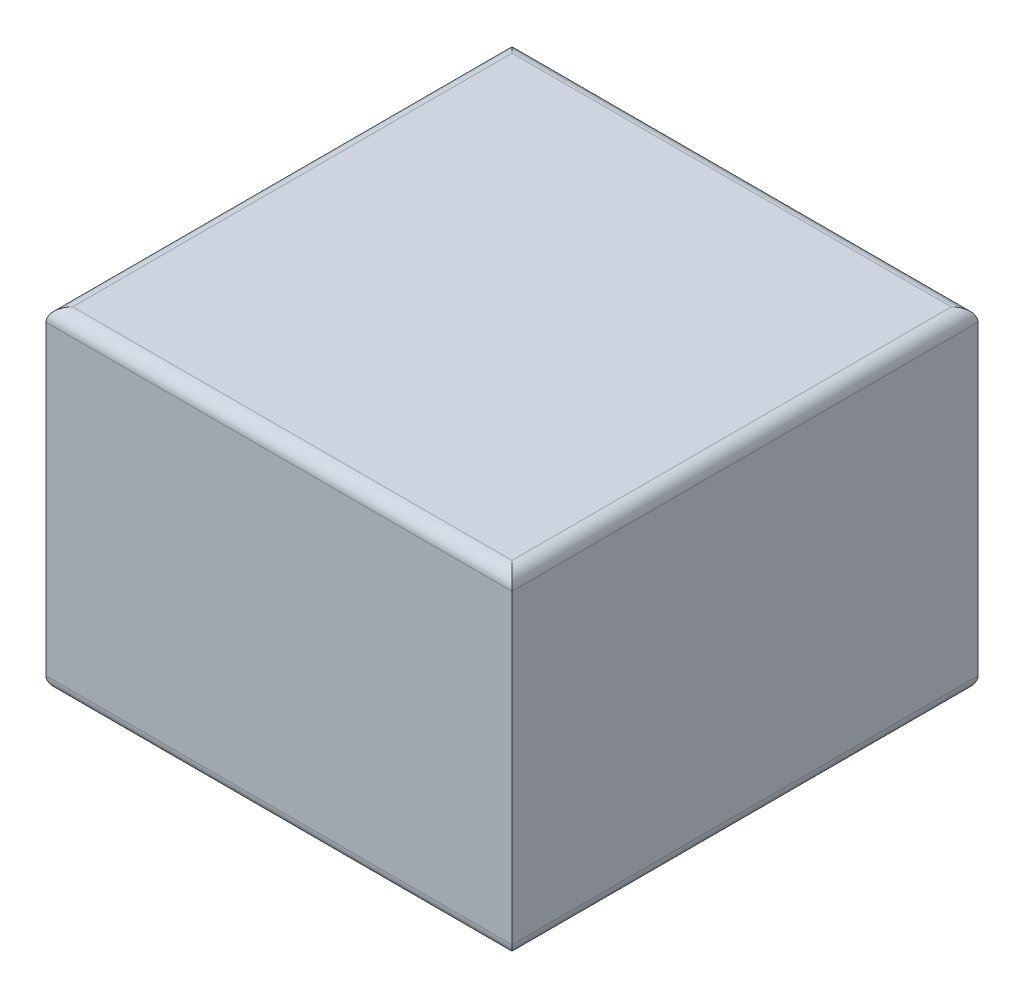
SolidWorks part; units mm, degrees
ref_plane "Front Plane" through (0, 0, 0) normal (0, 0, 1) x (1, 0, 0)
ref_plane "Top Plane" through (0, 0, 0) normal (0, 1, 0) x (1, 0, 0)
ref_plane "Right Plane" through (0, 0, 0) normal (1, 0, 0) x (0, 0, -1)
sketch "Sketch1" plane through (0, 0, 0) normal (0, 1, 0) x (1, 0, 0)
  line L1 (0, 0) -> (35, 0)
  line L2 (0, 0) -> (0, 35)
  line L3 (0, 35) -> (35, 35)
  line L4 (35, 0) -> (35, 35)
extrude "Boss-Extrude1" add sketch "Sketch1" along normal blind 25
fillet "Fillet1" radius 1 8 edges at (17.5, 0, 0) (35, 0, -17.5) (17.5, 0, -35) (0, 0, -17.5) (17.5, 25, -35) (35, 25, -17.5) (17.5, 25, 0) (0, 25, -17.5)
